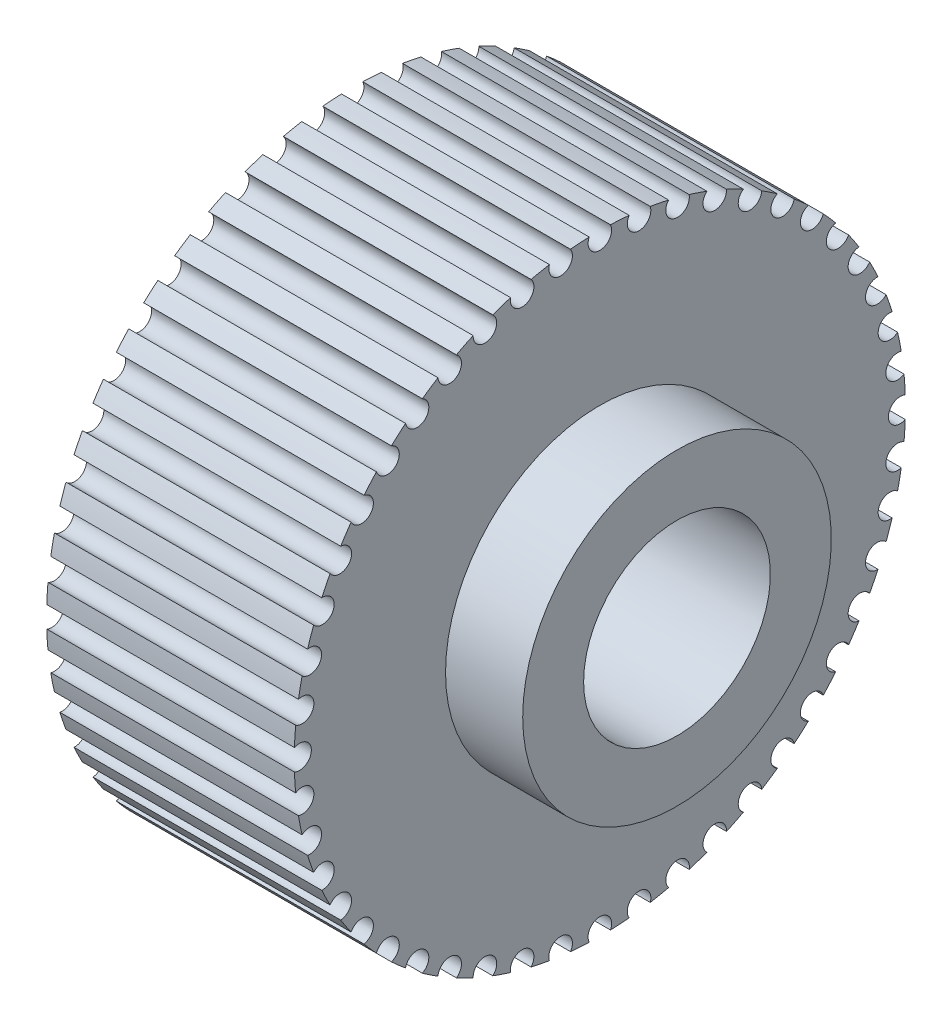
SolidWorks part; units mm, degrees
ref_plane "Alzado" through (0, 0, 0) normal (0, 0, 1) x (1, 0, 0)
ref_plane "Planta" through (0, 0, 0) normal (0, 1, 0) x (1, 0, 0)
ref_plane "Vista lateral" through (0, 0, 0) normal (1, 0, 0) x (0, 0, -1)
sketch "Croquis1" plane through (0, 0, 0) normal (0, 0, 1) x (1, 0, 0)
  line L0 (0, 0) -> (36, 0) construction
  line L1 (0, 11.5) -> (0, 37.625)
  line L2 (0, 37.625) -> (30.5, 37.625)
  line L3 (30.5, 37.625) -> (30.5, 19)
  line L4 (30.5, 19) -> (40, 19)
  line L5 (40, 19) -> (40, 11.5)
  line L6 (40, 11.5) -> (0, 11.5)
  line L7 (15.25, 37.625) -> (15.25, 0) construction
  dimension "b" = 30.5
  dimension "ØOuter" = 75.25
  dimension "Pilotbore" = 23
  dimension "L" = 40
  dimension "ND" = 38
revolve "Revolución1" add sketch "Croquis1" angle 360 about L0
sketch "Croquis3" plane through (0, 0, 0) normal (-1, 0, 0) x (0, 0, 1)
  line L0 (0, 0) -> (0, 37.625) construction
  line L1 (0, 35.525) -> (11.5474, 35.525) construction
  line L2 (0, 36.975) -> (-8.106, 36.975) construction
  circle A0 centre (0, 0) radius 37.625 construction
  circle A1 centre (0, 0) radius 35.525 construction
  circle A2 centre (0, 0) radius 36.975 construction
  circle A3 centre (0, 36.975) radius 1.45
  dimension "Cteprofdiente" = 2.1
  dimension "Øcentrodientes" = 0.65
extrude "Cortar-Extruir1" cut sketch "Croquis3" against normal through all
pattern_circular "MatrizC1" count 48 over 360 about axis through (0, 0, 0) along (1, 0, 0) of "Cortar-Extruir1"
sketch "Croquis2" [suppressed] plane through (0, 0, 0) normal (0, 0, 1) x (1, 0, 0)
  line L0 (0, 0) -> (40.4026, 0) construction
  line L1 (0, 11.5) -> (1.25, 11.5)
  line L2 (0, 11.5) -> (0, 27)
  line L3 (0, 27) -> (1.25, 27)
  line L4 (1.25, 11.5) -> (1.25, 27)
  line L5 (10.25, 24.8604) -> (10.25, 0) construction
  line L7 (19.25, 11.5) -> (19.25, 27)
  line L8 (20.5, 27) -> (19.25, 27)
  line L9 (20.5, 11.5) -> (20.5, 27)
  line L10 (20.5, 11.5) -> (19.25, 11.5)
  line L11 (0, 11.5) -> (0, -11.5) construction
  line L12 (0, 24.8604) -> (20.5, 24.8604) construction
  dimension "D1" = 23
  dimension "FlangedoutØ" = 1
  dimension "Distanciaentrechapas" = 28
revolve "Revolución2 Chapas laterales" [suppressed] add sketch "Croquis2" angle 360 about L0
equation "\"D1@Croquis2\"=\"Pilotbore@Croquis1\""
